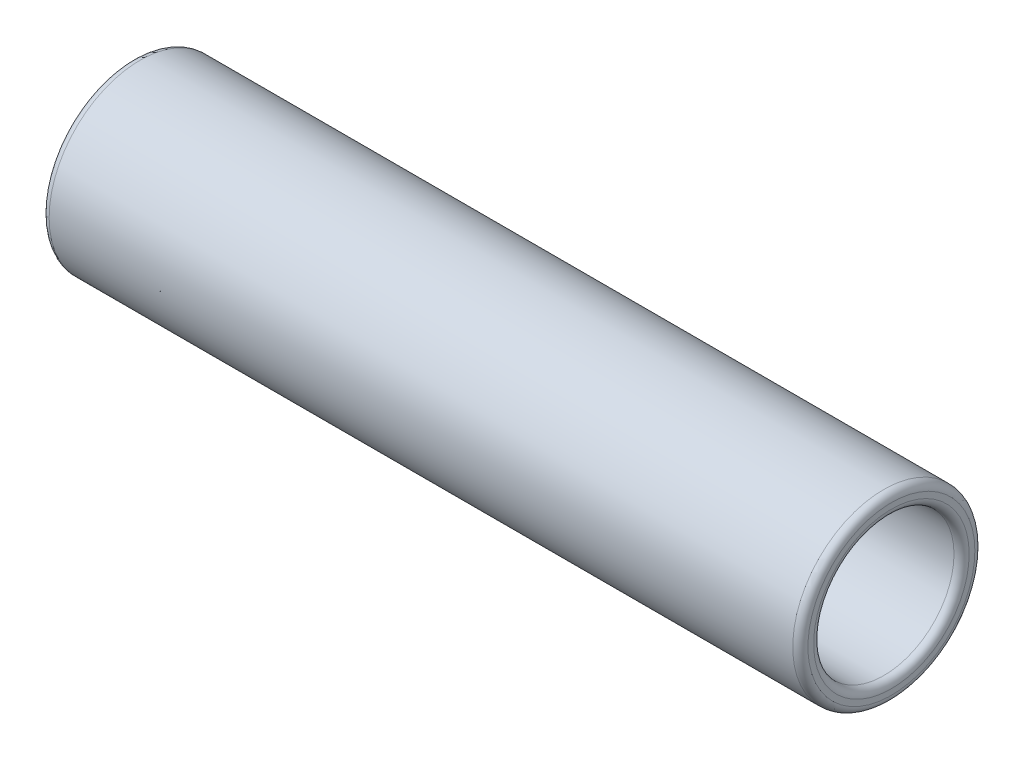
SolidWorks part; units mm, degrees
ref_plane "Plan de face" through (0, 0, 0) normal (0, 0, 1) x (1, 0, 0)
ref_plane "Plan de dessus" through (0, 0, 0) normal (0, 1, 0) x (1, 0, 0)
ref_plane "Plan de droite" through (0, 0, 0) normal (1, 0, 0) x (0, 0, -1)
sketch "Esquisse1" plane through (0, 0, 0) normal (0, 0, 1) x (1, 0, 0)
  line L0 (0, 0) -> (-18.3546, 0) construction
  line L2 (7.1292, 0.925) -> (-2.8708, 0.925)
  line L3 (7.1292, 0.925) -> (7.1292, 1.2)
  line L4 (7.1292, 1.2) -> (-2.8708, 1.2)
  line L5 (-2.8708, 0.925) -> (-2.8708, 1.2)
  dimension "D1" = 1.85
  dimension "D2" = 2.4
  dimension "D3" = 10
revolve "Révolution1" add sketch "Esquisse1" angle 360 about L0
fillet "Congé1" radius 0.1 4 edges at (-2.8708, 0, -0.925) (7.1292, 0, -0.925) (7.1292, 0, -1.2) (-2.8708, 0, -1.2)
